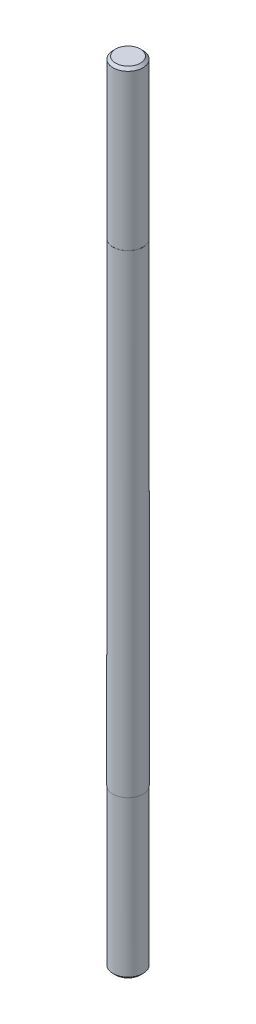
SolidWorks part; units mm, degrees
ref_plane "Front" through (0, 0, 0) normal (0, 0, 1) x (1, 0, 0)
ref_plane "Top" through (0, 0, 0) normal (0, 1, 0) x (1, 0, 0)
ref_plane "Right" through (0, 0, 0) normal (1, 0, 0) x (0, 0, -1)
sketch "Sketch1" plane through (0, 0, 0) normal (0, 1, 0) x (1, 0, 0)
  circle A0 centre (0, 0) radius 2
extrude "Extrude1" add sketch "Sketch1" along normal blind 105
sketch "Sketch2" plane through (0, 105, 0) normal (0, 1, 0) x (-1, 0, 0)
  circle A0 centre (0, 0) radius 2
  circle A1 centre (0, 0) radius 1.99
extrude "Cut-Extrude1" cut sketch "Sketch2" against normal blind 21
sketch "Sketch3" plane through (0, 0, 0) normal (0, -1, 0) x (1, 0, 0)
  circle A0 centre (0, 0) radius 2
  circle A1 centre (0, 0) radius 1.999
extrude "Cut-Extrude2" cut sketch "Sketch3" against normal blind 21
chamfer "Chamfer1" distance 0.35 angle 45 2 edges at (0, 0, -1.999) (0, 105, 1.99)
